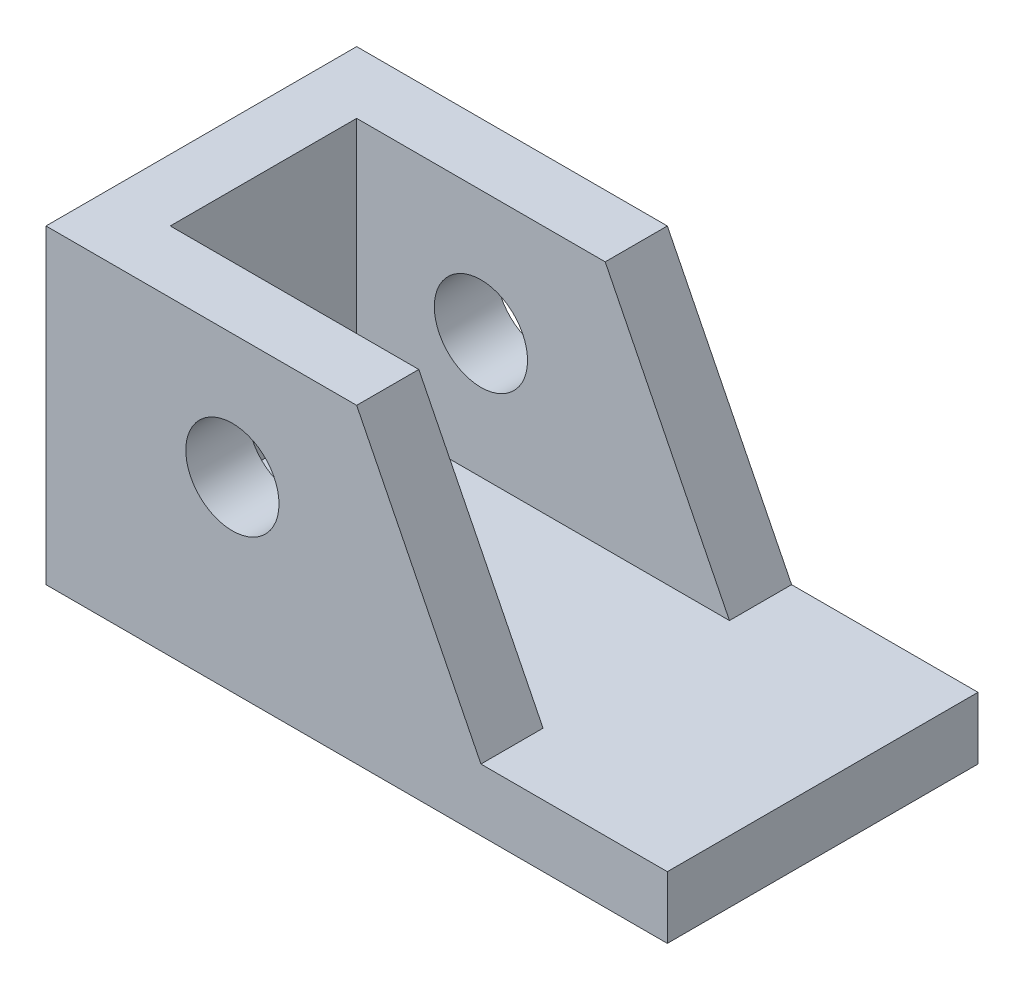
SolidWorks part; units mm, degrees
ref_plane "正面" through (0, 0, 0) normal (0, 0, 1) x (1, 0, 0)
ref_plane "平面" through (0, 0, 0) normal (0, 1, 0) x (1, 0, 0)
ref_plane "右側面" through (0, 0, 0) normal (1, 0, 0) x (0, 0, -1)
sketch "ｽｹｯﾁ1" plane through (0, 0, 0) normal (0, 1, 0) x (1, 0, 0)
  line L1 (0, 0) -> (100, 0)
  line L2 (0, 0) -> (0, 50)
  line L3 (0, 50) -> (100, 50)
  line L4 (100, 0) -> (100, 50)
  dimension "D1" = 100
  dimension "D2" = 50
extrude "押し出し1" add sketch "ｽｹｯﾁ1" along normal blind 50
sketch "ｽｹｯﾁ3" plane through (0, 0, 0) normal (0, 0, 1) x (1, 0, 0)
  line L0 (100, 10) -> (70, 10)
  line L1 (100, 50) -> (100, 0) construction
  line L2 (70, 10) -> (50, 50)
  line L3 (0, 50) -> (100, 50) construction
  line L4 (50, 50) -> (100, 50)
  line L5 (100, 50) -> (100, 10)
  line L6 (0, 50) -> (0, 0) construction
  line L7 (0, 0) -> (100, 0) construction
  dimension "D1" = 50
  dimension "D2" = 70
  dimension "D3" = 10
extrude "ｶｯﾄ - 押し出し1" cut sketch "ｽｹｯﾁ3" against normal through all
sketch "ｽｹｯﾁ4" plane through (0, 50, 0) normal (0, 1, 0) x (1, 0, 0)
  line L0 (100, 50) -> (100, 0) construction
  line L1 (10, 40) -> (100, 40)
  line L2 (10, 40) -> (10, 10)
  line L3 (10, 10) -> (100, 10)
  line L4 (100, 40) -> (100, 10)
  line L5 (0, 50) -> (0, 0) construction
  line L6 (0, 0) -> (50, 0) construction
  dimension "D1" = 10
  dimension "D2" = 10
  dimension "D3" = 30
extrude "ｶｯﾄ - 押し出し2" cut sketch "ｽｹｯﾁ4" against normal up to surface (40 mm away)
sketch "ｽｹｯﾁ5" plane through (0, 0, 0) normal (0, 0, 1) x (1, 0, 0)
  line L0 (0, 0) -> (100, 0) construction
  line L1 (0, 50) -> (0, 0) construction
  circle A0 centre (30, 30) radius 7.5
  dimension "D1" = 15
  dimension "D2" = 30
  dimension "D3" = 30
extrude "ｶｯﾄ - 押し出し3" cut sketch "ｽｹｯﾁ5" against normal through all
